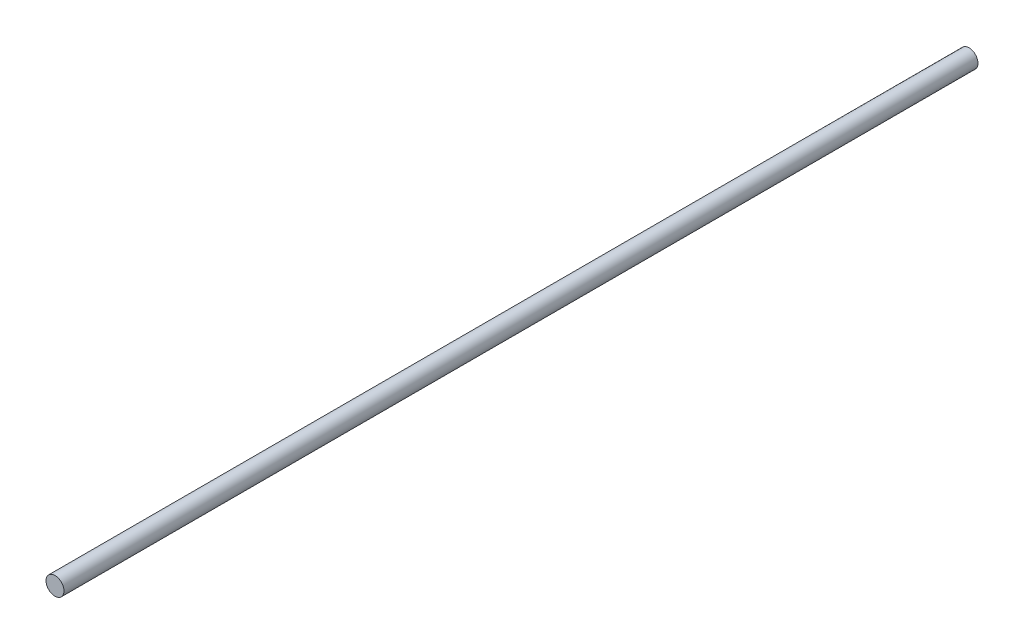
SolidWorks part; units mm, degrees
ref_plane "Front Plane" through (0, 0, 0) normal (0, 0, 1) x (1, 0, 0)
ref_plane "Top Plane" through (0, 0, 0) normal (0, 1, 0) x (1, 0, 0)
ref_plane "Right Plane" through (0, 0, 0) normal (1, 0, 0) x (0, 0, -1)
sketch "Sketch1" plane through (0, 0, 0) normal (0, 0, 1) x (1, 0, 0)
  circle A0 centre (0, 0) radius 30
  dimension "D1" = 60
extrude "Boss-Extrude1" add sketch "Sketch1" against normal blind 3050
